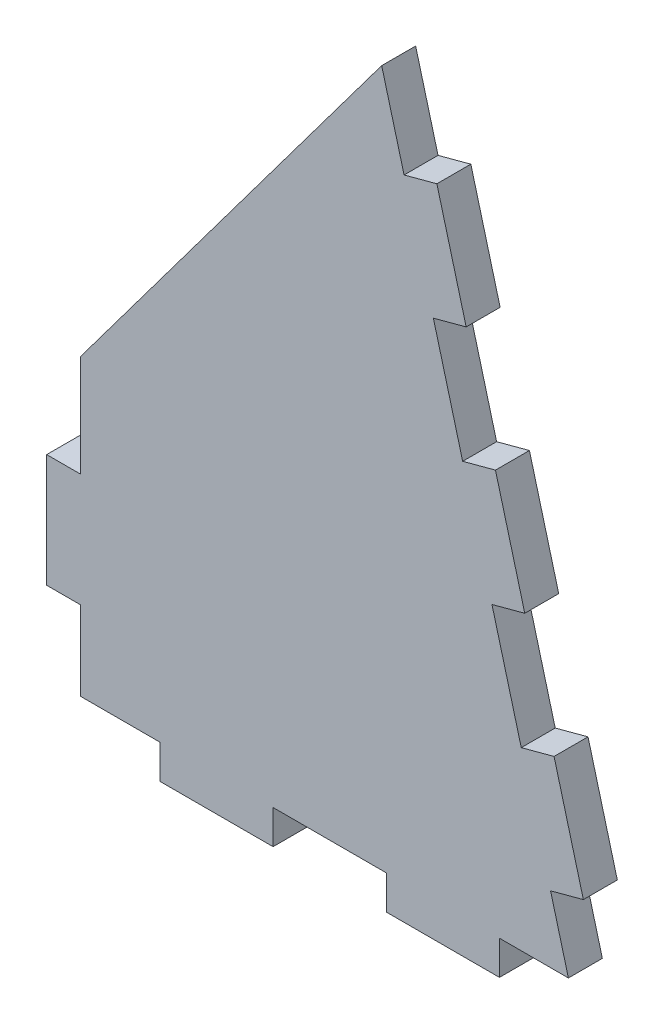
SolidWorks part; units mm, degrees
ref_plane "Front Plane" through (0, 0, 0) normal (0, 0, 1) x (1, 0, 0)
ref_plane "Top Plane" through (0, 0, 0) normal (0, 1, 0) x (1, 0, 0)
ref_plane "Right Plane" through (0, 0, 0) normal (1, 0, 0) x (0, 0, -1)
sketch "Sketch1" plane through (0, 0, 0) normal (0, 0, 1) x (1, 0, 0)
  line L0 (0, 0) -> (50, 0)
  line L1 (50, 0) -> (31.8827, 67.6148)
  line L2 (0, 0) -> (0, 25)
  line L3 (31.8827, 67.6148) -> (0, 25)
  line L4 (31.8827, 67.6148) -> (34.2881, 58.6375) construction
  dimension "D1" = 50
  dimension "D3" = 75
  dimension "D4" = 25
extrude "Boss-Extrude1" add sketch "Sketch1" against normal blind 3
sketch "Sketch2" plane through (0, 0, 0) normal (0, 0, 1) x (1, 0, 0)
  line L0 (31.8827, 67.6148) -> (34.4709, 57.9555)
  line L1 (31.8827, 67.6148) -> (28.9849, 66.8384)
  line L2 (34.4709, 57.9555) -> (31.5731, 57.1791)
  line L3 (28.9849, 66.8384) -> (31.5731, 57.1791)
  line L4 (50, 0) -> (31.8827, 67.6148) construction
  line L5 (37.059, 48.2963) -> (39.6472, 38.637)
  line L6 (34.1613, 47.5198) -> (36.7495, 37.8606)
  line L7 (37.059, 48.2963) -> (34.1613, 47.5198)
  line L8 (39.6472, 38.637) -> (36.7495, 37.8606)
  line L9 (42.2354, 28.9778) -> (44.8236, 19.3185)
  line L10 (39.3377, 28.2013) -> (41.9258, 18.5421)
  line L11 (42.2354, 28.9778) -> (39.3377, 28.2013)
  line L12 (44.8236, 19.3185) -> (41.9258, 18.5421)
  line L13 (47.4118, 9.6593) -> (50, 0)
  line L14 (44.514, 8.8828) -> (47.1022, -0.7765)
  line L15 (47.4118, 9.6593) -> (44.514, 8.8828)
  line L16 (50, 0) -> (47.1022, -0.7765)
  line L17 (31.8827, 67.6148) -> (37.059, 48.2963) construction
  dimension "D1" = 10
  dimension "D2" = 3
  dimension "D3" = 20
extrude "Cut-Extrude1" cut sketch "Sketch2" against normal blind 3
sketch "Sketch3" plane through (0, 0, 0) normal (0, 0, 1) x (1, 0, 0)
  line L0 (44.8236, 19.3185) -> (50, 0) construction
  line L1 (20, 3) -> (30, 3)
  line L2 (0, 0) -> (10, 0)
  line L3 (0, 0) -> (0, 3)
  line L4 (0, 3) -> (10, 3)
  line L5 (10, 0) -> (10, 3)
  line L6 (0, 0) -> (10, 3) construction
  line L7 (0, 3) -> (10, 0) construction
  line L8 (20, 0) -> (20, 3)
  line L9 (20, 0) -> (30, 0)
  line L10 (30, 0) -> (30, 3)
  line L11 (40, 3) -> (50, 3)
  line L12 (40, 0) -> (40, 3)
  line L13 (40, 0) -> (50, 0)
  line L14 (50, 0) -> (50, 3)
  line L15 (0, 3) -> (20, 3) construction
  point P8 (5, 1.5)
extrude "Cut-Extrude2" cut sketch "Sketch3" against normal blind 3
sketch "Sketch4" plane through (0, 0, 0) normal (0, 0, 1) x (1, 0, 0)
  line L0 (0, 30) -> (3, 30)
  line L1 (0, 0) -> (3, 0)
  line L2 (0, 0) -> (0, 10)
  line L3 (0, 10) -> (3, 10)
  line L4 (3, 0) -> (3, 10)
  line L5 (0, 0) -> (3, 10) construction
  line L6 (0, 10) -> (3, 0) construction
  line L7 (3, 20) -> (3, 30)
  line L8 (0, 20) -> (3, 20)
  line L9 (0, 20) -> (0, 30)
  line L10 (0, 10) -> (0, 30) construction
  point P4 (1.5, 5)
extrude "Cut-Extrude3" cut sketch "Sketch4" against normal blind 3
equation "\"finger_l\"= 10mm"
equation "\"finger_w\"= 3mm"
equation "\"D1@Sketch3\"=\"finger_l\""
equation "\"D2@Sketch3\"=\"finger_w\""
equation "\"D1@Sketch4\"=\"finger_w\""
equation "\"D2@Sketch4\"=\"finger_l\""
